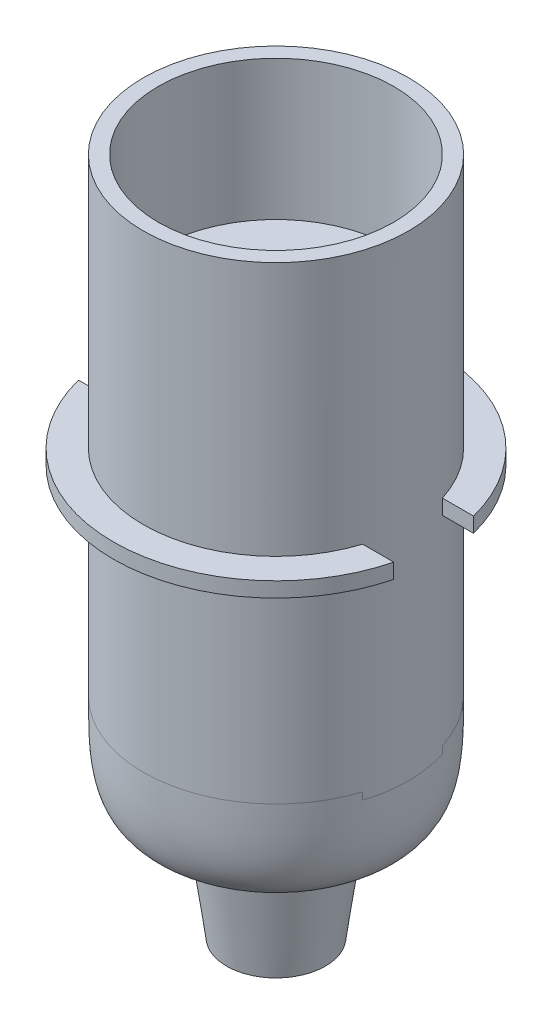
SolidWorks part; units mm, degrees
ref_plane "Plan de face" through (0, 0, 0) normal (0, 0, 1) x (1, 0, 0)
ref_plane "Plan de dessus" through (0, 0, 0) normal (0, 1, 0) x (1, 0, 0)
ref_plane "Plan de droite" through (0, 0, 0) normal (1, 0, 0) x (0, 0, -1)
sketch "Esquisse1" plane through (0, 0, 0) normal (0, 0, 1) x (1, 0, 0)
  line L0 (0, 68.8463) -> (0, -90.4126) construction
  line L1 (54.1202, 0) -> (-20.9738, 0) construction
  line L2 (-20.9738, 57) -> (54.1202, 57) construction
  line L3 (13.3, -6.5803) -> (13.3, 63.2343) construction
  line L4 (-11.9429, 31.5) -> (36.0947, 31.5) construction
  line L5 (11.8, 60.3978) -> (11.8, 35.6928) construction
  line L6 (-11.9429, 30) -> (36.0947, 30) construction
  line L7 (29.8726, 43) -> (-3.6164, 43) construction
  line L8 (25.9381, 10) -> (-15.6029, 10) construction
  line L9 (6.6, 47.6793) -> (6.6, 29.1048) construction
  line L10 (8.15, -10.0573) -> (8.15, 2.1122) construction
  line L11 (16.3, 37.6143) -> (16.3, 27.0003) construction
  line L12 (8.15, 0) -> (0, 0)
  line L13 (0, 0) -> (0, 30)
  line L14 (0, 30) -> (6.6, 30)
  line L15 (6.6, 30) -> (6.6, 43)
  line L16 (6.6, 43) -> (11.8, 43)
  line L17 (11.8, 43) -> (11.8, 57)
  line L18 (11.8, 57) -> (13.3, 57)
  line L19 (13.3, 57) -> (13.3, 31.5)
  line L20 (13.3, 31.5) -> (16.3, 31.5)
  line L21 (16.3, 31.5) -> (16.3, 30)
  line L22 (16.3, 30) -> (13.3, 30)
  line L23 (13.3, 30) -> (13.3, 10)
  spline S0 degree 3 poles (13.3, 10) (13.3072, 4.1301) (13.2116, 0.0241) (8.15, 0) knots 0 0 0 0 1 1 1 1
  dimension "D1" = 10
  dimension "D2" = 30
  dimension "D3" = 6.6
  dimension "D4" = 13.3
  dimension "D5" = 1.5
  dimension "D6" = 1.5
  dimension "D7" = 14
  dimension "D8" = 8.15
  dimension "D9" = 3
revolve "Révolution1" add sketch "Esquisse1" angle 360 about L0
sketch "Esquisse2" plane through (0, 0, 0) normal (0, -1, 0) x (1, 0, 0)
  circle A0 centre (0, 0) radius 6.5
extrude "Extrusion1" add sketch "Esquisse2" along normal blind 11 draft 8
sketch "Esquisse3" plane through (0, 0, 0) normal (0, 1, 0) x (1, 0, 0)
  line L0 (-19.7413, 0) -> (25.1488, 0) construction
  line L1 (19.2244, -4) -> (-18.6678, -4) construction
  line L2 (-18.6678, 4) -> (19.2244, 4) construction
  line L3 (12.6842, -4) -> (16.4386, -4)
  line L4 (12.6842, 4) -> (16.4386, 4)
  line L5 (-12.6842, 4) -> (-16.4386, 4)
  line L6 (-16.4386, -4) -> (-12.6842, -4)
  arc A0 (-12.6842, 4) -> (-12.6842, -4) centre (0, 0) ccw
  arc A1 (-16.4386, 4) -> (-16.4386, -4) centre (0, 0) ccw
  arc A2 (16.4386, -4) -> (16.4386, 4) centre (0, 0) ccw
  arc A3 (12.6842, -4) -> (12.6842, 4) centre (0, 0) ccw
  dimension "D1" = 4
  dimension "D2" = 4
extrude "Enlèv. mat.-Extru.1" cut sketch "Esquisse3" along normal blind 35
